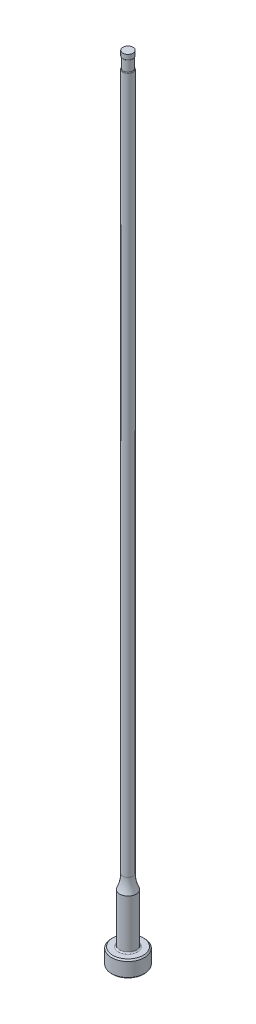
SolidWorks part; units mm, degrees
ref_plane "Front Plane" through (0, 0, 0) normal (0, 0, 1) x (1, 0, 0)
ref_plane "Top Plane" through (0, 0, 0) normal (0, 1, 0) x (1, 0, 0)
ref_plane "Right Plane" through (0, 0, 0) normal (1, 0, 0) x (0, 0, -1)
other "Configuration Table"
sketch "Sketch1" plane through (0, 0, 0) normal (0, 0, 1) x (1, 0, 0)
  line L0 (0, 259.9588) -> (0, -15.1925) construction
  line L1 (0, 0) -> (-3.175, 0)
  line L2 (-3.175, 0) -> (-3.175, 3.175)
  line L3 (-3.175, 3.175) -> (-1.5875, 3.175)
  line L4 (-0.9919, 15.3851) -> (-0.9919, 152.4)
  line L5 (-0.9919, 152.4) -> (0, 152.4)
  line L6 (0, 152.4) -> (0, 0)
  line L7 (-1.5875, 3.175) -> (-1.5875, 12.7)
  arc A1 (-1.5875, 12.7) -> (-0.9919, 15.3851) centre (-7.3419, 15.3851) ccw
  dimension "D1" = 6.35
  dimension "L" = 152.4
  dimension "D2" = 3.175
  dimension "H" = 6.35
  dimension "T" = 3.175
  dimension "D" = 1.9837
  dimension "S" = 12.7
revolve "Revolve1" add sketch "Sketch1" angle 360 about L0
chamfer "Chamfer1" distance 0.254 angle 45 2 edges at (0, 3.175, 3.175) (0, 0, 3.175)
fillet "Fillet1" radius 0.254 1 edges at (0, 3.175, 1.5875)
sketch "Sketch2" plane through (0, 0, 0) normal (0, 0, 1) x (1, 0, 0)
  line L0 (-0.9919, 152.4) -> (-0.9919, 15.3851) construction
  line L1 (-0.9919, 151.384) -> (-0.8903, 151.384)
  line L2 (-0.9919, 151.384) -> (-0.9919, 149.352)
  line L3 (-0.9919, 149.352) -> (-0.8903, 149.352)
  line L4 (-0.8903, 151.384) -> (-0.8903, 149.352)
  line L5 (0.9919, 152.4) -> (-0.9919, 152.4) construction
  line L6 (0, 153.4483) -> (0, 147.3282) construction
  dimension "D1" = 2.032
  dimension "N" = 1.016
  dimension "FD" = 0.1016
  dimension "D3" = 1.7805
revolve "Vent Relief" cut sketch "Sketch2" angle 360 about L6
sketch "Sketch3" plane through (0, 0, 0) normal (0, 0, 1) x (1, 0, 0)
  line L0 (-0.8903, 150.368) -> (-0.8903, 112.268)
  line L1 (-0.8903, 151.384) -> (-0.8903, 149.352) construction
  line L2 (-0.9919, 149.352) -> (-0.9919, 15.3851) construction
  line L3 (-0.9919, 111.4712) -> (-0.9919, 150.368)
  line L4 (-0.9919, 150.368) -> (-0.8903, 150.368)
  arc A0 (-0.8903, 112.268) -> (-0.9919, 111.4712) centre (-4.0653, 112.268) cw
  dimension "D1" = 3.175
  dimension "D2" = 38.1
extrude "D-Slot" cut sketch "Sketch3" against normal through all both and the other way through all
sketch "Sketch5" plane through (0, 0, 0) normal (0, 0, 1) x (1, 0, 0)
  line L0 (-0.9919, 151.384) -> (0.9919, 151.384) construction
  line L1 (-0.9919, 152.4) -> (-0.9868, 152.4)
  line L2 (-0.9919, 152.4) -> (-0.9919, 151.384)
  line L3 (-0.9919, 151.384) -> (-0.9868, 151.384)
  line L4 (-0.9868, 152.4) -> (-0.9868, 151.384)
  line L5 (0, 152.6877) -> (0, 150.5771) construction
  dimension "VP" = 0.0051
revolve "Vent Diameter" cut sketch "Sketch5" angle 360 about L5
fillet "Fillet2" radius 0.127 2 edges at (0.9919, 149.352, 0) (0, 151.384, 0.9868)
sketch "Pocket Sketch" plane through (0, 0, 0) normal (0, 0, 1) x (1, 0, 0)
  line L0 (-3.5719, 0) -> (-3.5719, 3.2004)
  line L1 (-3.5719, 3.2004) -> (-1.9523, 3.2004)
  line L2 (-1.1903, 3.9624) -> (-1.1903, 22.225)
  line L3 (-1.1903, 22.225) -> (0, 22.225)
  line L4 (0, 22.225) -> (0, 0)
  line L5 (0, 0) -> (-3.5719, 0)
  line L6 (0, 12.6104) -> (0, -2.4989) construction
  line L7 (-3.175, 2.921) -> (-3.175, 0.254) construction
  line L8 (2.921, 3.175) -> (-2.921, 3.175) construction
  line L9 (-0.9919, 111.4712) -> (-0.9919, 15.3851) construction
  line L10 (-1.9523, 3.2004) -> (-1.1903, 3.9624)
  point P3 (-1.1903, 3.2004)
  dimension "D1" = 7.1437
  dimension "D2" = 0.3969
  dimension "D3" = 0.0254
  dimension "D4" = 0.1984
  dimension "D5" = 2.3806
  dimension "D6" = 22.225
